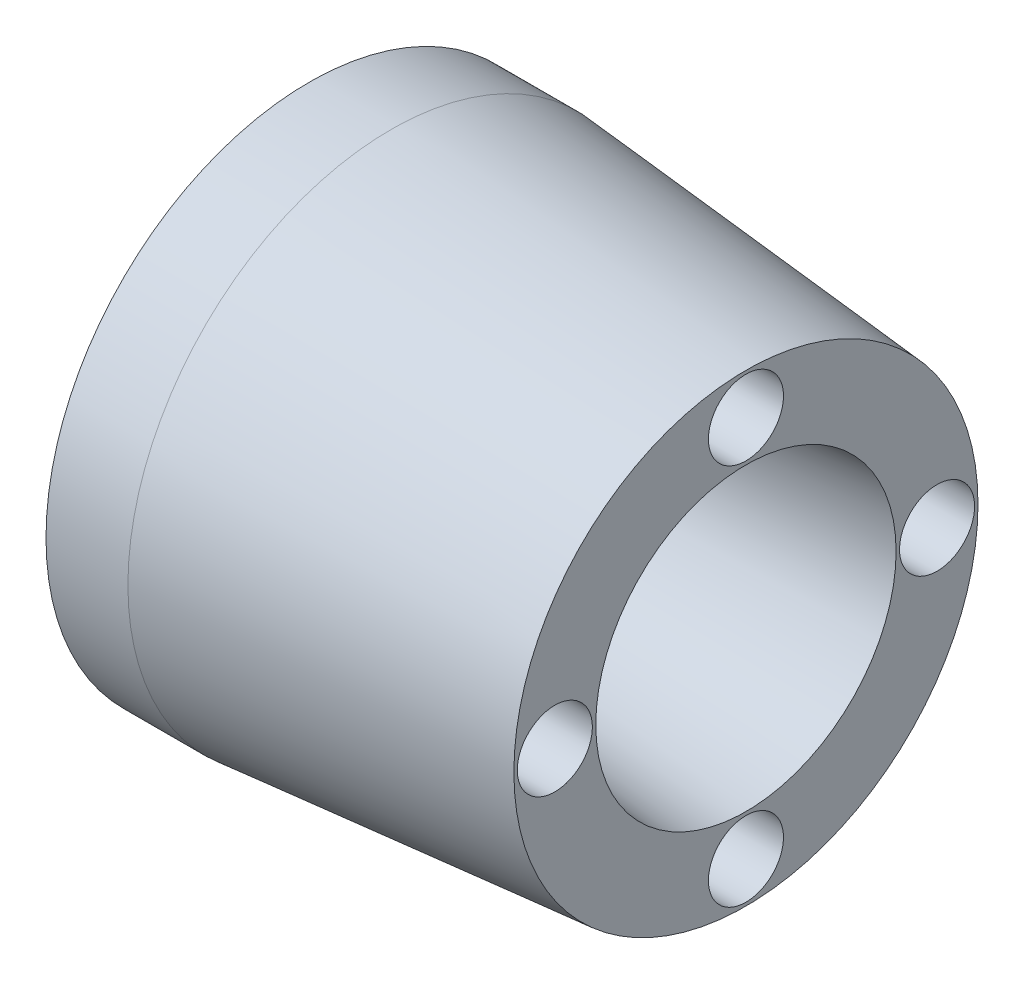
SolidWorks part; units mm, degrees
ref_plane "Front Plane" through (0, 0, 0) normal (0, 0, 1) x (1, 0, 0)
ref_plane "Top Plane" through (0, 0, 0) normal (0, 1, 0) x (1, 0, 0)
ref_plane "Right Plane" through (0, 0, 0) normal (1, 0, 0) x (0, 0, -1)
sketch "Sketch1" plane through (0, 0, 0) normal (0, 0, 1) x (1, 0, 0)
  line L0 (0, 0) -> (20, 0) construction
  line L1 (0, 0) -> (0, 3) construction
  line L2 (0, 3) -> (20, 3)
  line L3 (20, 3) -> (20, 11)
  line L4 (20, 11) -> (0, 11)
  line L5 (0, 11) -> (0, 10)
  line L6 (0, 10) -> (18.5, 8.3815)
  line L7 (18.5, 8.3815) -> (18.5, 5.6185)
  line L8 (18.5, 5.6185) -> (0, 4)
  line L9 (0, 4) -> (0, 3)
  line L10 (18.5, 7) -> (20, 7) construction
  line L11 (0, 9.6372) -> (0, 4.3628)
  line L12 (0, 4.3628) -> (3, 4.3628)
  line L13 (3, 4.3628) -> (16, 5.5002)
  line L14 (16, 5.5002) -> (16, 8.4998)
  line L15 (16, 8.4998) -> (3, 9.6372)
  line L16 (3, 9.6372) -> (0, 9.6372)
  line L17 (20, 3) -> (20, 0) construction
  dimension "D1" = 3
  dimension "D2" = 11
  dimension "D3" = 20
  dimension "D4" = 1
  dimension "D5" = 5
  dimension "D6" = 1.5
  dimension "D7" = 0.1
  dimension "D8" = 0.1
  dimension "D9" = 4
  dimension "D10" = 3
  dimension "D11" = 3
revolve "Revolve1" add sketch "Sketch1" angle 360 about L0
sketch "Sketch2" plane through (16, 0, 0) normal (1, 0, 0) x (0, 0, -1)
  circle A0 centre (0, 0) radius 7
  circle A1 centre (0, 7) radius 1.375
  dimension "D1" = 2.75
  dimension "D2" = 14
extrude "Cut-Extrude1" cut sketch "Sketch2" against normal blind 15 contours A0 A1 | A0 A1
pattern_circular "CirPattern1" count 4 over 360 about axis through (0, 0, 0) along (1, 0, 0) of "Cut-Extrude1"
